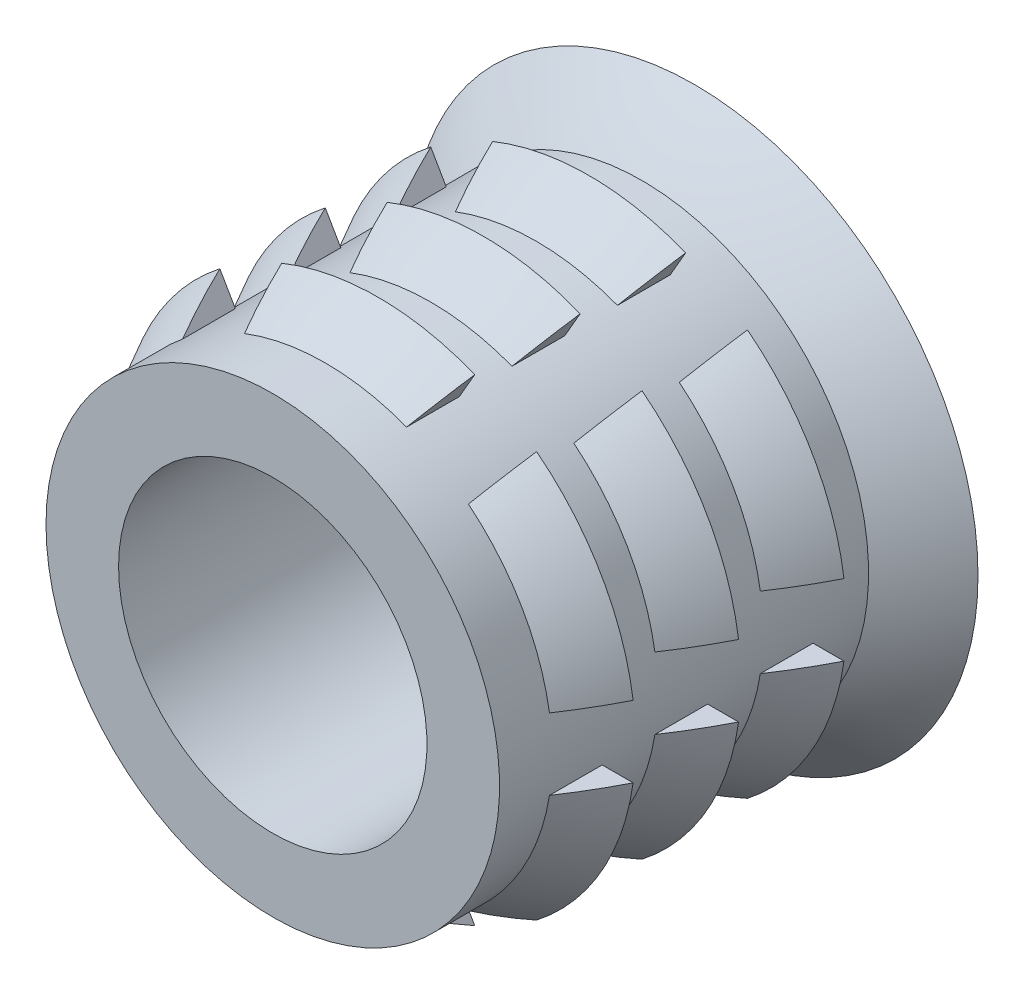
SolidWorks part; units mm, degrees
other "<insert 8-32 S1>-<CirPattern1>"
ref_plane "Front" through (0, 0, 0) normal (0, 0, 1) x (1, 0, 0)
ref_plane "Top" through (0, 0, 0) normal (0, 1, 0) x (1, 0, 0)
ref_plane "Right" through (0, 0, 0) normal (1, 0, 0) x (0, 0, -1)
inserted part "insert 8-32 S1"
move or copy body "Body-Move/Copy2"
